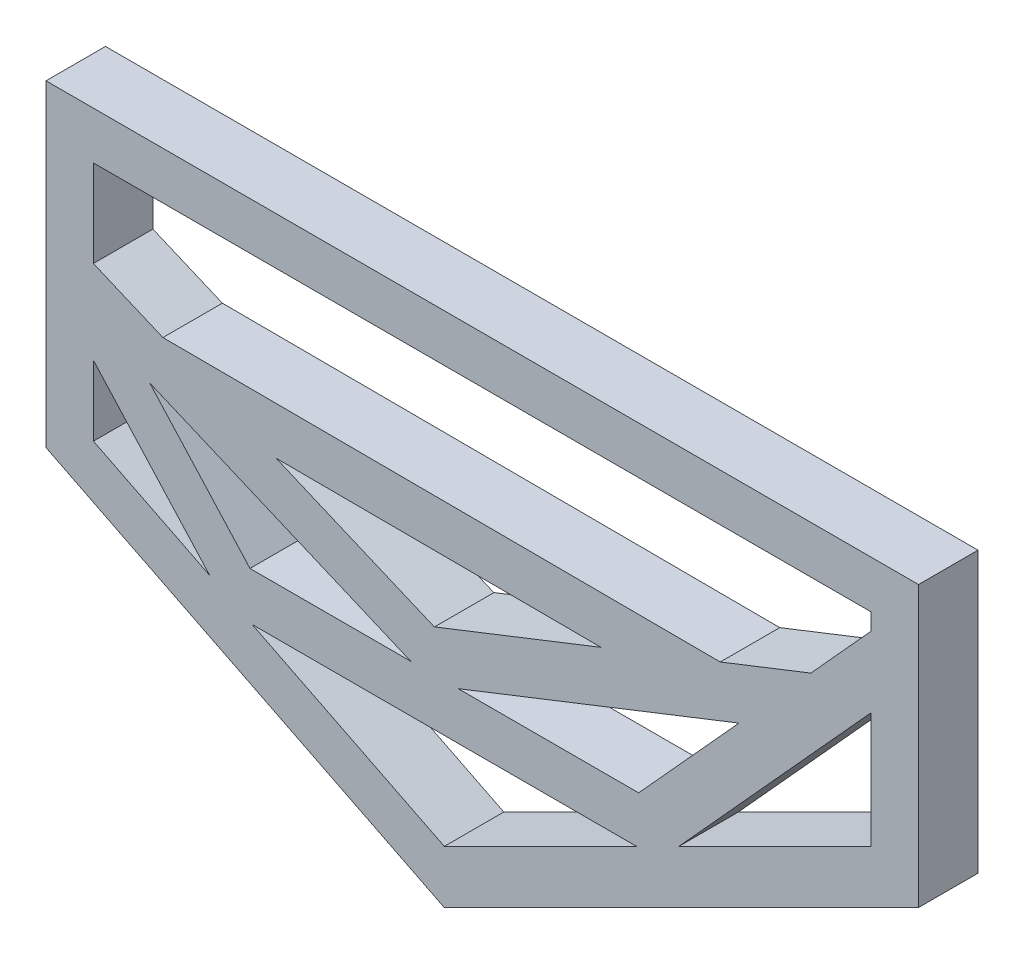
SolidWorks part; units mm, degrees
ref_plane "Front Plane" through (0, 0, 0) normal (0, 0, 1) x (1, 0, 0)
ref_plane "Top Plane" through (0, 0, 0) normal (0, 1, 0) x (1, 0, 0)
ref_plane "Right Plane" through (0, 0, 0) normal (1, 0, 0) x (0, 0, -1)
sketch "Sketch1" plane through (0, 0, 0) normal (0, 0, 1) x (1, 0, 0)
  line L0 (-67.8571, 50.4152) -> (-67.8571, 28.0445)
  line L1 (-83, 120.1429) -> (-83, 18.6857)
  line L2 (-67.8571, 105) -> (-67.8571, 77.1958)
  line L3 (180.4857, 105) -> (180.4857, 99.6595)
  line L4 (195.6286, 120.1429) -> (195.6286, 30.8)
  line L5 (44.2, -27.9841) -> (105.5708, 2.7013)
  line L6 (-67.8571, 28.0445) -> (-30.7149, 9.4734)
  line L8 (-83, 120.1429) -> (195.6286, 120.1429)
  line L9 (-83, 18.6857) -> (44.2, -44.9143)
  line L10 (44.2, -44.9143) -> (195.6286, 30.8)
  line L11 (-67.8571, 105) -> (180.4857, 105)
  line L18 (-9.5483, 52.5105) -> (94.2623, 52.0836)
  line L19 (-45.6682, 67.802) -> (132.3229, 67.0701)
  line L21 (-67.8571, 50.4152) -> (-30.7149, 9.4734)
  line L22 (-17.1708, 2.7013) -> (105.5708, 2.7013)
  line L23 (119.1149, 9.4734) -> (180.4857, 77.1223)
  line L26 (-17.8632, 17.8442) -> (33.4944, 17.8442)
  line L27 (106.2632, 17.8442) -> (138.2872, 53.1441)
  line L28 (-49.8872, 53.1441) -> (33.4944, 17.8442)
  line L29 (48.6373, 17.8442) -> (138.2872, 53.1441)
  line L30 (41.0659, 31.1374) -> (41.0659, 31.0828)
  line L31 (-17.1708, 2.7013) -> (44.2, -27.9841)
  line L33 (-67.8571, 77.1958) -> (-45.6682, 67.802)
  line L34 (41.0659, 31.1374) -> (94.2623, 52.0836)
  line L37 (119.1149, 9.4734) -> (180.4857, 40.1588)
  line L39 (48.6373, 17.8442) -> (106.2632, 17.8442)
  line L43 (-9.5483, 52.5105) -> (41.0659, 31.0828)
  line L44 (180.4857, 77.1223) -> (180.4857, 40.1588)
  line L52 (-49.8872, 53.1441) -> (-17.8632, 17.8442)
  line L54 (161.2561, 78.4627) -> (180.4857, 99.6595)
  line L57 (132.3229, 67.0701) -> (161.2561, 78.4627)
extrude "Boss-Extrude1" add sketch "Sketch1" along normal blind 19
